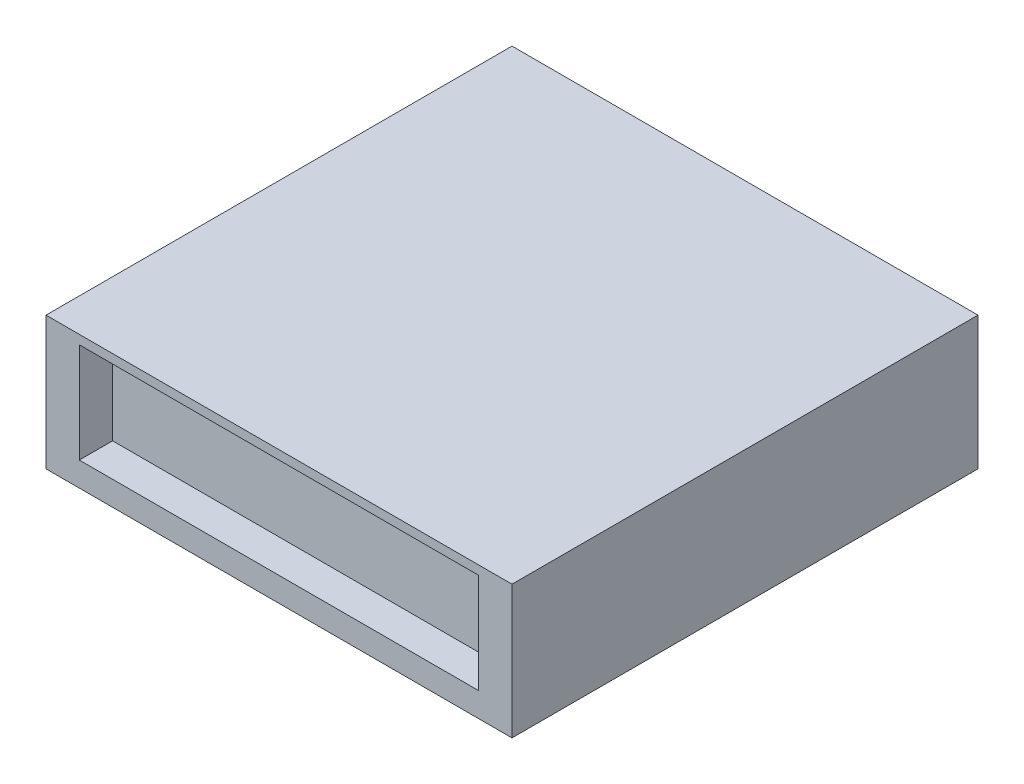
SolidWorks part; units mm, degrees
ref_plane "Front Plane" through (0, 0, 0) normal (0, 0, 1) x (1, 0, 0)
ref_plane "Top Plane" through (0, 0, 0) normal (0, 1, 0) x (1, 0, 0)
ref_plane "Right Plane" through (0, 0, 0) normal (1, 0, 0) x (0, 0, -1)
sketch "Sketch1" plane through (0, 0, 0) normal (0, 1, 0) x (1, 0, 0)
  line L1 (0, 0) -> (88.9, 0)
  line L2 (0, 0) -> (0, 88.9)
  line L3 (0, 88.9) -> (88.9, 88.9)
  line L4 (88.9, 0) -> (88.9, 88.9)
  dimension "D1" = 88.9
  dimension "D2" = 88.9
extrude "Boss-Extrude1" add sketch "Sketch1" along normal blind 25.4
sketch "Sketch2" plane through (0, 0, 0) normal (0, 0, 1) x (1, 0, 0)
  line L0 (44.45, 0) -> (44.45, 4.6331) construction
  line L1 (6.35, 23.6831) -> (82.55, 23.6831)
  line L2 (6.35, 23.6831) -> (6.35, 4.6331)
  line L3 (6.35, 4.6331) -> (82.55, 4.6331)
  line L4 (82.55, 23.6831) -> (82.55, 4.6331)
  line L5 (0, 0) -> (88.9, 0) construction
  dimension "D1" = 19.05
  dimension "D2" = 76.2
extrude "Cut-Extrude1" cut sketch "Sketch2" against normal blind 6.35
